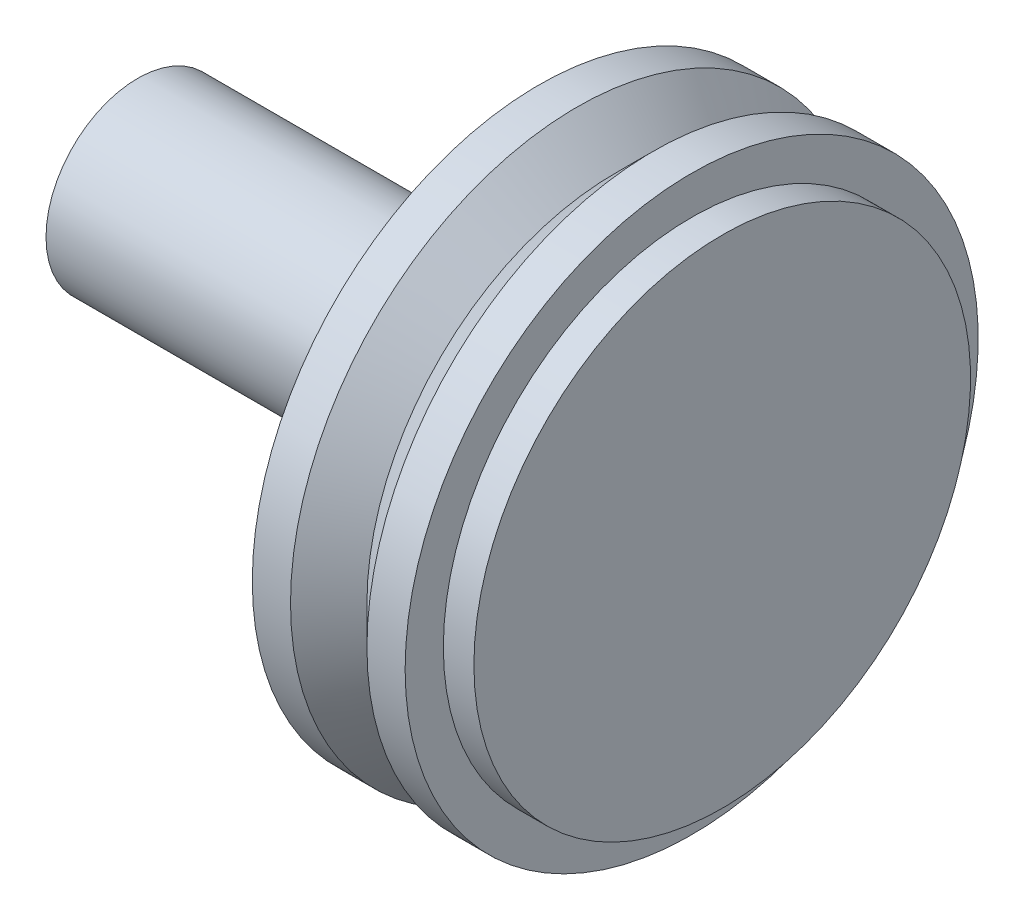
SolidWorks part; units mm, degrees
ref_plane "Front Plane" through (0, 0, 0) normal (0, 0, 1) x (1, 0, 0)
ref_plane "Top Plane" through (0, 0, 0) normal (0, 1, 0) x (1, 0, 0)
ref_plane "Right Plane" through (0, 0, 0) normal (1, 0, 0) x (0, 0, -1)
sketch "Sketch1" plane through (0, 0, 0) normal (0, 0, 1) x (1, 0, 0)
  line L0 (145, -75) -> (135, -75)
  line L1 (135, -75) -> (125, -65)
  line L2 (125, -65) -> (115, -75)
  line L3 (115, -75) -> (105, -75)
  line L4 (105, -75) -> (105, -24)
  line L5 (105, -24) -> (0, -24)
  line L6 (0, -24) -> (0, 0)
  line L7 (0, 0) -> (153, 0)
  line L8 (145, -75) -> (145, -65)
  line L9 (145, -65) -> (153, -65)
  line L10 (153, -65) -> (153, 0)
  dimension "D1" = 40
  dimension "D2" = 75
  dimension "D3" = 10
  dimension "D4" = 90
  dimension "D5" = 8
  dimension "D6" = 65
  dimension "D7" = 24
  dimension "D8" = 105
revolve "Revolve1" add sketch "Sketch1" angle 360 about L7
